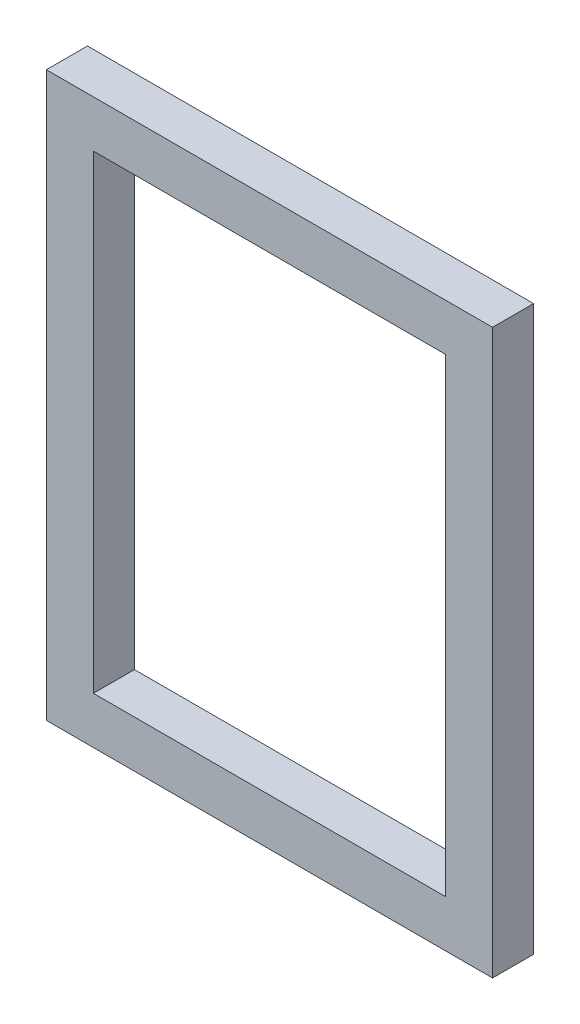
SolidWorks part; units mm, degrees
ref_plane "Vorne" through (0, 0, 0) normal (0, 0, 1) x (1, 0, 0)
ref_plane "Oben" through (0, 0, 0) normal (0, 1, 0) x (1, 0, 0)
ref_plane "Rechts" through (0, 0, 0) normal (1, 0, 0) x (0, 0, -1)
sketch "Skizze1" plane through (0, 0, 0) normal (0, 0, 1) x (1, 0, 0)
  line L0 (300, 1400) -> (600, 1400) construction
  line L1 (600, 1400) -> (600, 1000) construction
  line L2 (300, 1000) -> (600, 1000) construction
  line L3 (300, 1400) -> (300, 1000) construction
  line L4 (300, 1400) -> (600, 1400)
  line L5 (600, 1400) -> (600, 1000)
  line L6 (300, 1000) -> (600, 1000)
  line L7 (300, 1400) -> (300, 1000)
ref_plane "Ebene1" through (300, 1000, 0) normal (0, -1, 0) x (1, 0, 0)
sketch "Skizze2" plane through (300, 1000, 0) normal (0, -1, 0) x (1, 0, 0)
  line L1 (-40, 35) -> (0, 35)
  line L2 (-40, 35) -> (-40, 0)
  line L3 (-40, 0) -> (0, 0)
  line L4 (0, 35) -> (0, 0)
  dimension "D1" = 35
  dimension "D2" = 40
sweep "Austragung1" add profiles "Skizze2" path "Skizze1"
